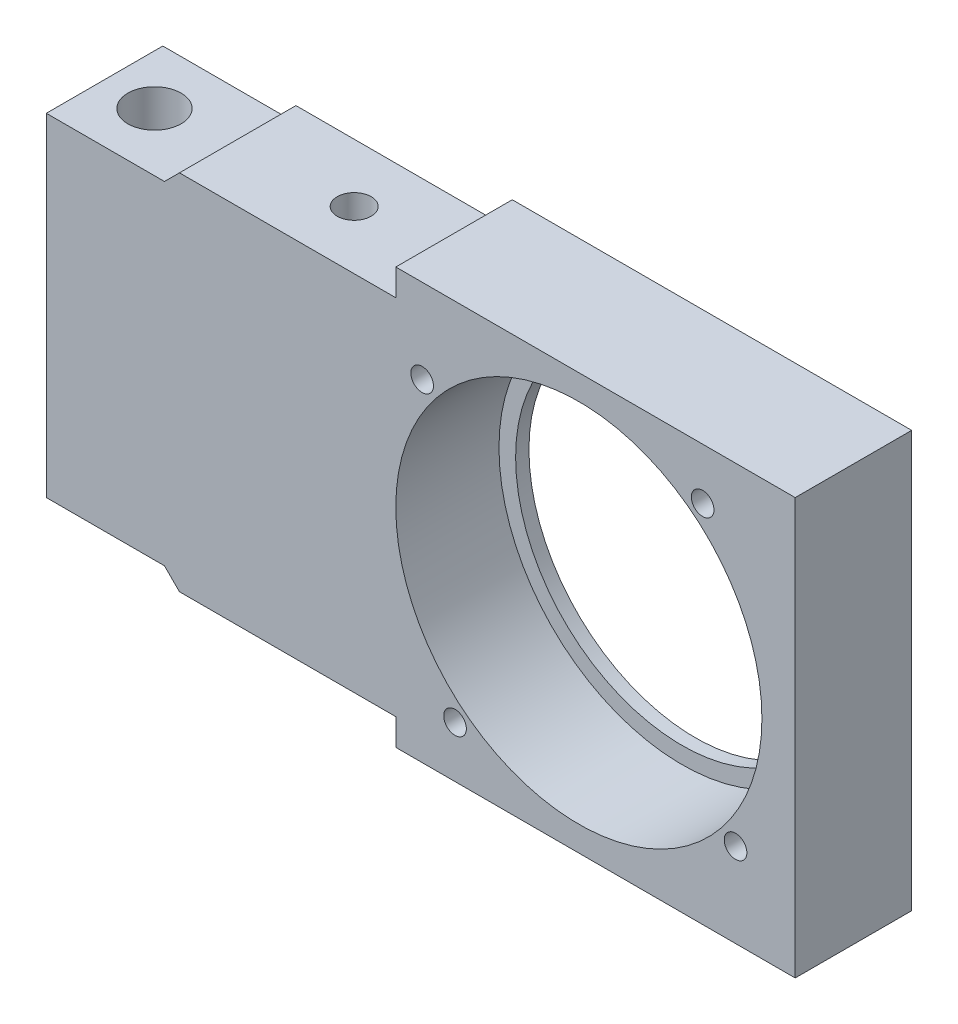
SolidWorks part; units mm, degrees
ref_plane "Face" through (0, 0, 0) normal (0, 0, 1) x (1, 0, 0)
ref_plane "Dessus" through (0, 0, 0) normal (0, 1, 0) x (1, 0, 0)
ref_plane "Droite" through (0, 0, 0) normal (1, 0, 0) x (0, 0, -1)
sketch "Esquisse1" plane through (0, 0, 0) normal (0, 0, 1) x (1, 0, 0)
  line L0 (65, -62.5) -> (65, 62.5)
  line L1 (65, 62.5) -> (-55, 62.5)
  line L2 (-55, 62.5) -> (-55, 54.5)
  line L3 (-55, 54.5) -> (-120, 54.5)
  line L4 (-120, 54.5) -> (-124.5, 50)
  line L5 (-124.5, 50) -> (-160, 50)
  line L6 (-160, 50) -> (-160, -50)
  line L7 (-135.0042, 0) -> (88.8289, 0) construction
  line L8 (-124.5, -50) -> (-160, -50)
  line L9 (-120, -54.5) -> (-124.5, -50)
  line L10 (-55, -54.5) -> (-120, -54.5)
  line L11 (-55, -62.5) -> (-55, -54.5)
  line L12 (65, -62.5) -> (-55, -62.5)
  point P12 (-160, 0)
  point P17 (65, 0)
  dimension "D1" = 125
  dimension "D2" = 120
  dimension "D3" = 65
  dimension "D4" = 120
  dimension "D5" = 109
  dimension "D6" = 45
  dimension "D7" = 100
  dimension "D8" = 160
extrude "Extrusion1" add sketch "Esquisse1" along normal mid plane 35
sketch "Esquisse2" plane through (0, 0, 0) normal (0, 1, 0) x (1, 0, 0)
  line L0 (50, 27.5) -> (50, 13.5)
  line L1 (50, 13.5) -> (55, 13.5)
  line L2 (55, 13.5) -> (55, -27.5)
  line L3 (0, 39.916) -> (0, -41.6667) construction
  line L4 (50, 27.5) -> (0, 27.5)
  line L5 (0, 27.5) -> (0, -27.5)
  line L6 (0, -27.5) -> (55, -27.5)
  line L7 (65, 17.5) -> (-55, 17.5) construction
  line L8 (65, -17.5) -> (-55, -17.5) construction
  dimension "D1" = 110
  dimension "D2" = 4
  dimension "D3" = 10
  dimension "D4" = 10
  dimension "D5" = 100
revolve "Enlèvement de matière-Révolution1" cut sketch "Esquisse2" angle 360 about L3
hole_wizard "Trou taraudé M12x1.751" positions "Esquisse4" profile "Esquisse3" tap size "M12x1.75" standard "Ansi Métrique"
sketch "Esquisse4" plane through (0, 54.5, 0) normal (0, 1, 0) x (-1, 0, 0)
  line L0 (55, 17.5) -> (120, 17.5) construction
  point P0 (85, 0)
  dimension "D1" = 85
  dimension "D2" = 17.5
sketch "Esquisse3" plane through (-85, 54.5, 0) normal (1, 0, 0) x (0, 0, 1)
  line L0 (0, 0) -> (0, 35.8144)
  line L1 (0, 35.8144) -> (5.1, 32.75)
  line L2 (5.1, 32.75) -> (5.1, 0)
  line L5 (5.1, 0) -> (0, 0)
  line L10 (0, 35.8144) -> (-5.1, 32.75) construction
  line L11 (0, -6.35) -> (0, 107.95) construction
  dimension "Diamètre du trou pour taraudage" = 10.2
  dimension "Profondeur du trou pour taraudage" = 32.75
  dimension "Angle de pointe" = 118
sketch "Esquisse5" plane through (0, 0, 0) normal (0, 1, 0) x (1, 0, 0)
  line L0 (-124.5, 17.5) -> (-160, 17.5) construction
  line L1 (-160, -17.5) -> (-160, 17.5) construction
  circle A0 centre (-145, 0) radius 8
  dimension "D3" = 16
  dimension "D1" = 17.5
  dimension "D2" = 15
extrude "Enlèv. mat.-Extru.1" cut sketch "Esquisse5" against normal through all and the other way through all
hole_wizard "Trou taraudé M8x1.251" positions "Esquisse7" profile "Esquisse6" tap size "M8x1.25" standard "Ansi Métrique"
sketch "Esquisse7" plane through (0, 0, 17.5) normal (0, 0, 1) x (1, 0, 0)
  point P1 (37.1955, 47.0797)
  point P2 (47.0797, -37.1955)
  point P4 (-37.1955, -47.0797)
  point P6 (-47.0797, 37.1955)
sketch "Esquisse6" plane through (37.1955, 47.0797, 17.5) normal (1, 0, 0) x (0, -1, 0)
  line L0 (0, 0) -> (0, 24.2929)
  line L1 (0, 24.2929) -> (3.4, 22.25)
  line L2 (3.4, 22.25) -> (3.4, 0)
  line L5 (3.4, 0) -> (0, 0)
  line L10 (0, 24.2929) -> (-3.4, 22.25) construction
  line L11 (0, -6.35) -> (0, 107.95) construction
  dimension "Diamètre du trou pour taraudage" = 6.8
  dimension "Profondeur du trou pour taraudage" = 22.25
  dimension "Angle de pointe" = 118
